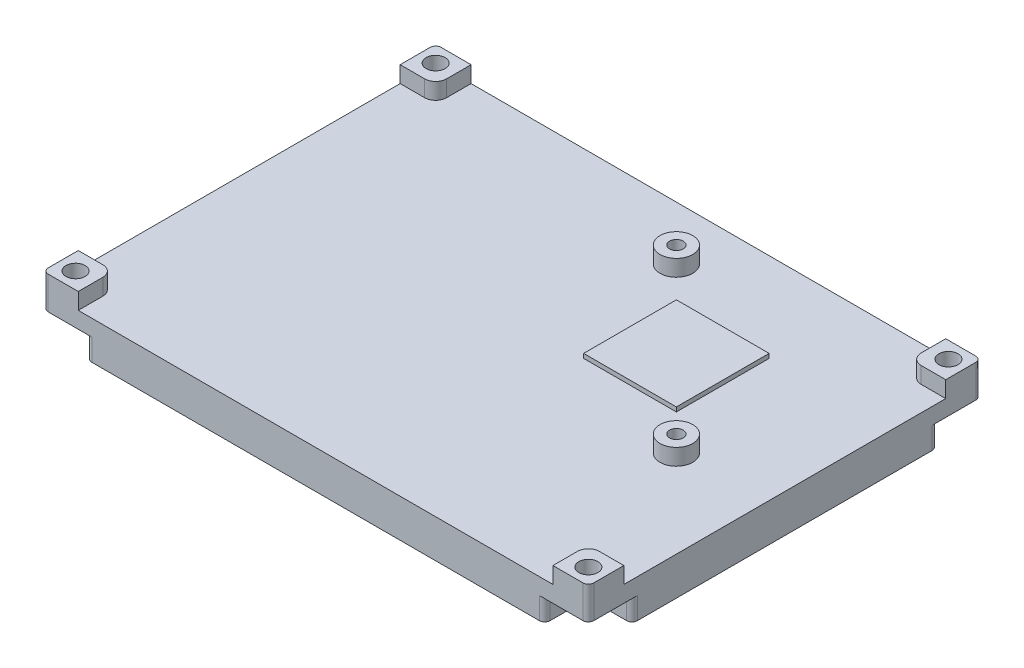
SolidWorks part; units mm, degrees
ref_plane "Front Plane" through (0, 0, 0) normal (0, 0, 1) x (1, 0, 0)
ref_plane "Top Plane" through (0, 0, 0) normal (0, 1, 0) x (1, 0, 0)
ref_plane "Right Plane" through (0, 0, 0) normal (1, 0, 0) x (0, 0, -1)
sketch "Sketch1" plane through (0, 0, 0) normal (0, 1, 0) x (1, 0, 0)
  line L1 (0, 0) -> (100, 0)
  line L2 (0, 0) -> (0, 72)
  line L3 (0, 72) -> (100, 72)
  line L4 (100, 0) -> (100, 72)
  circle A0 centre (3, 69) radius 1.75
  circle A1 centre (97, 69) radius 1.75
  circle A2 centre (97, 3) radius 1.75
  circle A3 centre (3, 3) radius 1.75
  dimension "D3" = 3.5
  dimension "D4" = 3
  dimension "D5" = 69
  dimension "D6" = 3
  dimension "D7" = 97
  dimension "D1" = 100
  dimension "D2" = 72
extrude "Boss-Extrude1" add sketch "Sketch1" along normal blind 10
sketch "Sketch2" plane through (0, 10, 0) normal (0, 1, 0) x (1, 0, 0)
  line L0 (100, 72) -> (0, 72) construction
  line L1 (6.5, 72) -> (93.5, 72)
  line L2 (6.5, 72) -> (6.5, 65.5)
  line L3 (6.5, 0) -> (93.5, 0)
  line L4 (93.5, 72) -> (93.5, 65.5)
  line L5 (0, 72) -> (0, 0) construction
  line L6 (0, 65.5) -> (6.5, 65.5)
  line L7 (0, 65.5) -> (0, 6.5)
  line L8 (0, 6.5) -> (6.5, 6.5)
  line L9 (100, 65.5) -> (100, 6.5)
  line L10 (100, 0) -> (100, 72) construction
  line L11 (93.5, 65.5) -> (100, 65.5)
  line L12 (6.5, 6.5) -> (6.5, 0)
  line L13 (93.5, 6.5) -> (100, 6.5)
  line L14 (93.5, 6.5) -> (93.5, 0)
  line L15 (0, 0) -> (100, 0) construction
  line L16 (68.94, 55.69) -> (68.94, 38.69) construction
  line L17 (60.44, 55.69) -> (77.44, 55.69)
  line L18 (60.44, 55.69) -> (60.44, 38.69)
  line L19 (60.44, 38.69) -> (77.44, 38.69)
  line L20 (77.44, 55.69) -> (77.44, 38.69)
  line L21 (60.44, 47.19) -> (77.44, 47.19) construction
  circle A0 centre (53.94, 62.19) radius 3
  circle A1 centre (83.94, 32.19) radius 3
  dimension "D5" = 6
  dimension "D6" = 53.94
  dimension "D7" = 83.94
  dimension "D8" = 32.19
  dimension "D9" = 62.19
  dimension "D1" = 17
  dimension "D2" = 68.94
  dimension "D3" = 47.19
  dimension "D4" = 6.5
extrude "Cut-Extrude1" cut sketch "Sketch2" against normal blind 3
sketch "Sketch3" plane through (0, 10, 0) normal (0, 1, 0) x (1, 0, 0)
  circle A0 centre (53.94, 62.19) radius 1.25
  circle A1 centre (83.94, 32.19) radius 1.25
  dimension "D1" = 2.5
extrude "Cut-Extrude2" cut sketch "Sketch3" against normal blind 6
sketch "Sketch4" plane through (0, 0, 0) normal (0, -1, 0) x (1, 0, 0)
  line L0 (25, -36) -> (0, -36) construction
  line L1 (25, -11) -> (75, -11) construction
  line L2 (25, -11) -> (25, -61) construction
  line L3 (25, -61) -> (75, -61) construction
  line L4 (75, -11) -> (75, -61) construction
  line L5 (0, -72) -> (0, 0) construction
  line L6 (50, -61) -> (50, -72) construction
  line L7 (100, -72) -> (0, -72) construction
  line L8 (0, -72) -> (0, 0) construction
  line L9 (100, 0) -> (100, -72) construction
  circle A1 centre (25, -11) radius 1.25
  circle A2 centre (75, -11) radius 1.25
  circle A3 centre (75, -61) radius 1.25
  circle A4 centre (25, -61) radius 1.25
  dimension "D2" = 2.5
  dimension "D1" = 50
extrude "Cut-Extrude3" cut sketch "Sketch4" against normal blind 6
sketch "Sketch6" plane through (0, 10, 0) normal (0, 1, 0) x (1, 0, 0)
  line L1 (60.44, 55.69) -> (77.44, 55.69)
  line L2 (60.44, 55.69) -> (60.44, 38.69)
  line L3 (60.44, 38.69) -> (77.44, 38.69)
  line L4 (77.44, 55.69) -> (77.44, 38.69)
extrude "Cut-Extrude4" cut sketch "Sketch6" against normal blind 2.2
sketch "Sketch7" plane through (0, 0, 0) normal (0, -1, 0) x (1, 0, 0)
  line L1 (0, 0) -> (8, 0)
  line L2 (0, 0) -> (0, -8)
  line L3 (0, -8) -> (8, -8)
  line L4 (8, 0) -> (8, -8)
  line L5 (100, 0) -> (92, 0)
  line L6 (100, 0) -> (100, -8)
  line L7 (100, -8) -> (92, -8)
  line L8 (92, 0) -> (92, -8)
  line L9 (0, -72) -> (8, -72)
  line L10 (0, -72) -> (0, -64)
  line L11 (0, -64) -> (8, -64)
  line L12 (8, -72) -> (8, -64)
  line L13 (100, -72) -> (92, -72)
  line L14 (100, -72) -> (100, -64)
  line L15 (100, -64) -> (92, -64)
  line L16 (92, -72) -> (92, -64)
  dimension "D1" = 8
extrude "Cut-Extrude5" cut sketch "Sketch7" against normal blind 4
fillet "Fillet2" radius 2 8 edges at (8, 2, -8) (8, 2, -64) (92, 2, -64) (92, 2, -8) (6.5, 8.5, -6.5) (93.5, 8.5, -6.5) (93.5, 8.5, -65.5) (6.5, 8.5, -65.5)
fillet "Fillet3" radius 1 12 edges at (0, 2, -8) (8, 2, 0) (8, 2, -72) (0, 2, -64) (92, 2, -72) (100, 2, -64) (92, 2, 0) (100, 2, -8) (0, 7, 0) (0, 7, -72) (100, 7, 0) (100, 7, -72)
